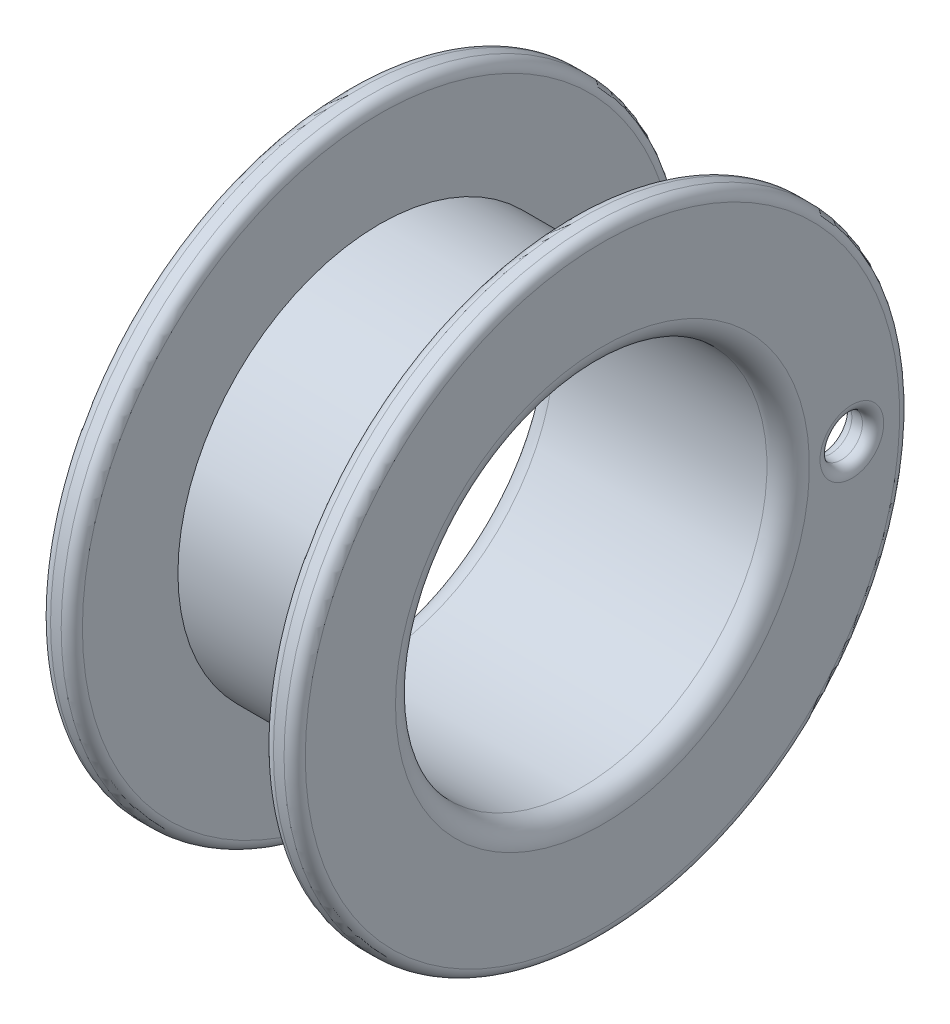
SolidWorks part; units mm, degrees
ref_plane "Plan de face" through (0, 0, 0) normal (0, 0, 1) x (1, 0, 0)
ref_plane "Plan de dessus" through (0, 0, 0) normal (0, 1, 0) x (1, 0, 0)
ref_plane "Plan de droite" through (0, 0, 0) normal (1, 0, 0) x (0, 0, -1)
sketch "Esquisse1" plane through (0, 0, 0) normal (0, 1, 0) x (1, 0, 0)
  line L0 (0, 0) -> (0, 29)
  line L1 (0, 29) -> (3, 29)
  line L2 (3, 29) -> (3, 19)
  line L3 (3, 19) -> (21, 19)
  line L4 (21, 19) -> (21, 29)
  line L5 (21, 29) -> (24, 29)
  line L6 (24, 29) -> (24, 0)
  line L7 (24, 0) -> (0, 0)
  line L8 (0, 0) -> (53.0539, 0) construction
  point P3 (12, 0)
  dimension "D1" = 29
  dimension "D2" = 19
  dimension "D3" = 18
  dimension "D4" = 3
  dimension "D5" = 3
  dimension "D6" = 29
revolve "Révolution1" add sketch "Esquisse1" angle 360 about L8
sketch "Esquisse2" plane through (0, 0, 0) normal (1, 0, 0) x (0, 0, -1)
  circle A0 centre (0, 0) radius 17.5
  dimension "D1" = 35
extrude "Enlèv. mat.-Extru.1" cut sketch "Esquisse2" along normal through all
fillet "Congé1" radius 1 4 edges at (0, 0, 29) (3, 0, 29) (21, 0, 29) (24, 0, 29)
fillet "Congé2" radius 2 2 edges at (0, 0, -17.5) (24, 0, -17.5)
sketch "Esquisse3" plane through (0, 0, 0) normal (1, 0, 0) x (0, 0, -1)
  circle A0 centre (23.5, 0) radius 2
  dimension "D1" = 23.5
extrude "Enlèv. mat.-Extru.2" cut sketch "Esquisse3" along normal through all contours A0
fillet "Congé3" radius 1 4 edges at (0, 0, -25.5) (24, 0, -25.5) (3, 0, -21.5) (21, 0, -25.5)
